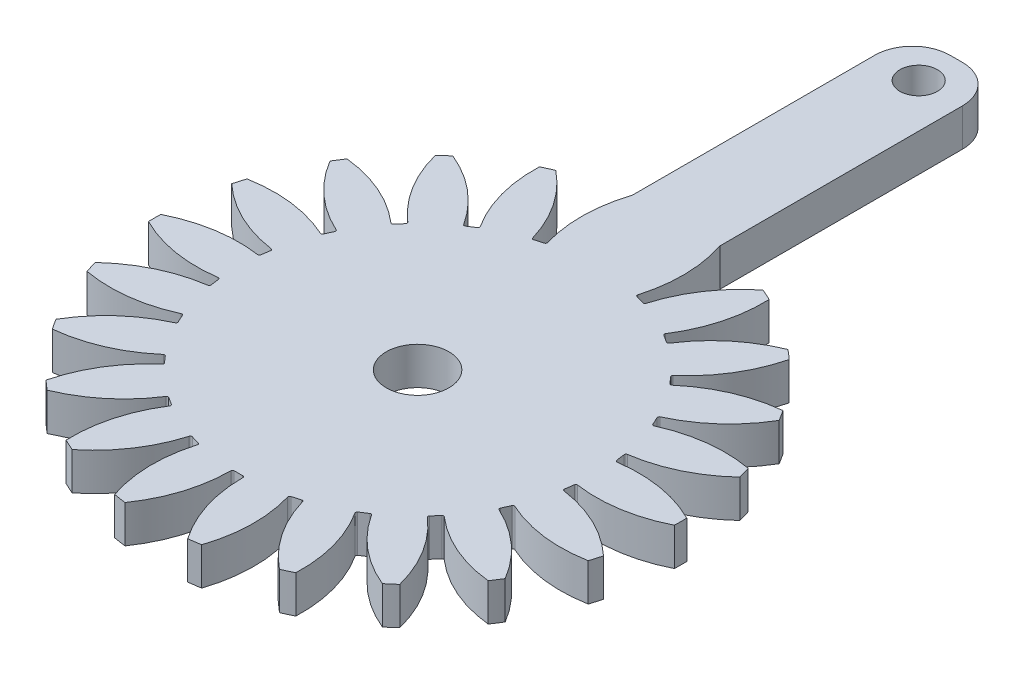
SolidWorks part; units mm, degrees
ref_plane "Front Plane" through (0, 0, 0) normal (0, 0, 1) x (1, 0, 0)
ref_plane "Top Plane" through (0, 0, 0) normal (0, 1, 0) x (1, 0, 0)
ref_plane "Right Plane" through (0, 0, 0) normal (1, 0, 0) x (0, 0, -1)
sketch "Sketch1" plane through (0, 0, 0) normal (0, 1, 0) x (1, 0, 0)
  circle A0 centre (0, 0) radius 21
  dimension "D1" = 42
extrude "Boss-Extrude1" add sketch "Sketch1" along normal blind 3
sketch "Sketch2" plane through (0, 3, 0) normal (0, 1, 0) x (1, 0, 0)
  circle A0 centre (0, 0) radius 2.5
  dimension "D1" = 5
extrude "Cut-Extrude1" cut sketch "Sketch2" against normal through all both and the other way through all
sketch "Sketch3" plane through (0, 3, 0) normal (0, 1, 0) x (1, 0, 0)
  line L0 (0, 0) -> (0, 21) construction
  line L1 (0.35, 14.3) -> (-0.35, 14.3)
  circle A0 centre (0, 0) radius 21 construction
  arc A3 (-2.5, 20.8507) -> (2.5, 20.8507) centre (0, 0) cw
  arc A6 (-0.35, 14.3) -> (-0.4765, 14.4265) centre (-0.35, 14.4265) cw
  arc A7 (-0.4765, 14.4265) -> (-2.5, 20.8507) centre (-11.6858, 14.4265) ccw
  arc A8 (0.35, 14.3) -> (0.4765, 14.4265) centre (0.35, 14.4265) ccw
  arc A9 (0.4765, 14.4265) -> (2.5, 20.8507) centre (11.6858, 14.4265) cw
  point P21 (0, 21)
  point P22 (0, 14.3)
  dimension "D4" = 6.7
  dimension "D1" = 5
  dimension "D2" = 0.7
extrude "Cut-Extrude2" cut sketch "Sketch3" against normal through all both and the other way through all
pattern_circular "CirPattern1" count 22 over 360 about axis through (0, 0, 0) along (0, 1, 0) of "Cut-Extrude2"
sketch "Sketch4" plane through (0, 3, 0) normal (0, 1, 0) x (1, 0, 0)
  line L0 (0, 27.75) -> (0, 0) construction
  line L1 (-3.5, 43) -> (3.5, 43)
  line L2 (-3.5, 43) -> (-3.5, 12.5)
  line L3 (-3.5, 12.5) -> (3.5, 12.5)
  line L4 (3.5, 43) -> (3.5, 12.5)
  line L5 (-3.5, 43) -> (3.5, 12.5) construction
  line L6 (-3.5, 12.5) -> (3.5, 43) construction
  point P0 (0, 27.75)
  dimension "D1" = 7
  dimension "D2" = 30.5
  dimension "D3" = 12.5
extrude "Boss-Extrude2" add sketch "Sketch4" against normal blind 3
fillet "Fillet1" radius 3 2 edges at (3.5, 1.5, -43) (-3.5, 1.5, -43)
sketch "Sketch5" plane through (0, 3, 0) normal (0, 1, 0) x (1, 0, 0)
  line L0 (0, 43) -> (0, 40) construction
  line L1 (0.5, 43) -> (-0.5, 43) construction
  circle A0 centre (0, 40) radius 1.5
  dimension "D2" = 3
  dimension "D1" = 3
extrude "Cut-Extrude3" cut sketch "Sketch5" against normal through all both and the other way through all
sketch "Sketch6" plane through (0, 3, 0) normal (0, 1, 0) x (1, 0, 0)
  line L0 (0.5, 43) -> (-0.5, 43) construction
  line L1 (0, 0) -> (0, 43) construction
